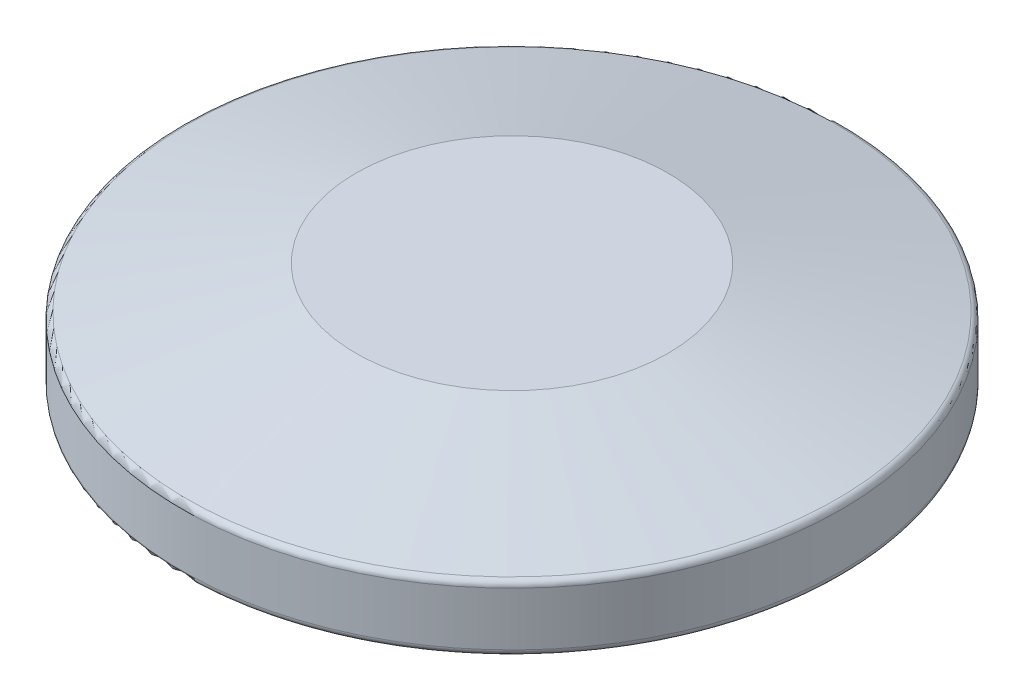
SolidWorks part; units mm, degrees
ref_plane "前视基准面" through (0, 0, 0) normal (0, 0, 1) x (1, 0, 0)
ref_plane "上视基准面" through (0, 0, 0) normal (0, 1, 0) x (1, 0, 0)
ref_plane "右视基准面" through (0, 0, 0) normal (1, 0, 0) x (0, 0, -1)
other "Configuration Table"
sketch "草图1" plane through (0, 0, 0) normal (0, 0, 1) x (1, 0, 0)
  line L0 (0, 0) -> (-3.625, 0)
  line L1 (-3.625, 0) -> (-6.2, 0)
  line L2 (-6.2, 0) -> (-15.2, 0)
  line L3 (-15.2, 0) -> (-15.2, 3)
  line L4 (-15.2, 3) -> (-7.2, 5)
  line L5 (-7.2, 5) -> (0, 5)
  line L6 (0, 5) -> (0, 0)
  line L7 (-6.2, 0) -> (-6.2, 2.5)
  line L8 (-6.2, 2.5) -> (-3.625, 2.5)
  line L9 (-3.625, 2.5) -> (-3.625, 0)
  dimension "D1" = 3.625
  dimension "D2" = 2.575
  dimension "D3" = 9
  dimension "D4" = 3
  dimension "D5" = 5
  dimension "D6" = 7.2
  dimension "D7" = 2.5
revolve "旋转2" add sketch "草图1" angle 360 about L6
fillet "圆角1" radius 0.3 1 edges at (-15.2, 3, 0)
fillet "圆角2" radius 0.3 1 edges at (-15.2, 0, 0)
fillet "圆角3" radius 0.3 1 edges at (-6.2, 0, 0)
fillet "圆角4" radius 0.1 1 edges at (-3.625, 0, 0)
